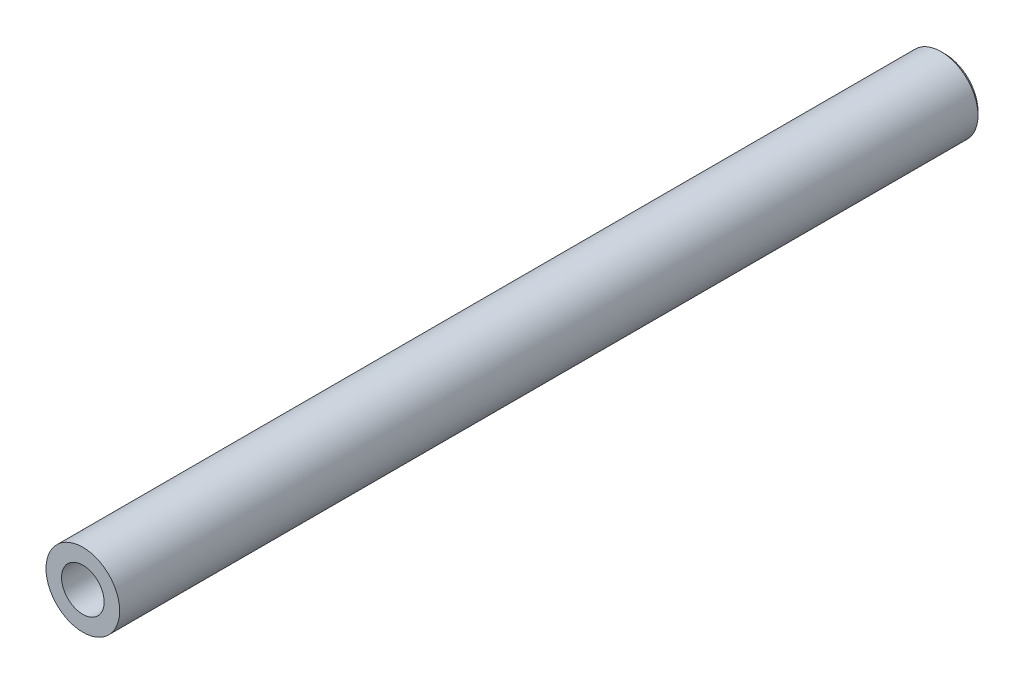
SolidWorks part; units mm, degrees
ref_plane "Front Plane" through (0, 0, 0) normal (0, 0, 1) x (1, 0, 0)
ref_plane "Top Plane" through (0, 0, 0) normal (0, 1, 0) x (1, 0, 0)
ref_plane "Right Plane" through (0, 0, 0) normal (1, 0, 0) x (0, 0, -1)
sketch "Sketch6" plane through (0, 0, 0) normal (0, 0, -1) x (-1, 0, 0)
  circle A0 centre (0, 0) radius 2.9845
  point P3 (0, 0)
extrude "Extrude2" add sketch "Sketch6" along normal blind 69.85 separate body
chamfer "Chamfer1" distance 0.2984 angle 45 1 edges at (-2.9845, 0, -69.85)
hole_wizard "3/16 (0.1875) Diameter Hole1" positions "Sketch12" profile "Sketch11" hole size "3/16" standard "ANSI Inch"
sketch "Sketch12" plane through (0, 0, -69.85) normal (0, 0, -1) x (-1, 0, 0)
  point P0 (0, 0)
sketch "Sketch11" plane through (0, 0, -69.85) normal (1, 0, 0) x (0, 1, 0)
  line L0 (0, 0) -> (0, 7.7808)
  line L1 (0, 7.7808) -> (2.3812, 6.35)
  line L2 (2.3812, 6.35) -> (2.3812, 0)
  line L5 (2.3812, 0) -> (0, 0)
  line L10 (0, 7.7808) -> (-2.3813, 6.35) construction
  line L11 (0, -6.35) -> (0, 107.95) construction
  dimension "Hole Dia." = 4.7625
  dimension "Hole Depth" = 6.35
  dimension "Drill Angle" = 118
hole_wizard "#8-32 Tapped Hole1" positions "Sketch13" profile "Sketch14" tap size "#8-32" standard "ANSI Inch"
sketch "Sketch13" plane through (0, 0, 0) normal (0, 0, 1) x (1, 0, 0)
  point P0 (0, 0)
sketch "Sketch14" plane through (0, 0, 0) normal (1, 0, 0) x (0, -1, 0)
  line L0 (0, 0) -> (0, 17.5478)
  line L1 (0, 17.5478) -> (1.7272, 16.51)
  line L2 (1.7272, 16.51) -> (1.7272, 0)
  line L5 (1.7272, 0) -> (0, 0)
  line L10 (0, 17.5478) -> (-1.7272, 16.51) construction
  line L11 (0, -6.35) -> (0, 107.95) construction
  dimension "Tap Drill Dia." = 3.4544
  dimension "Tap Drill Depth" = 16.51
  dimension "Drill Angle" = 118
equation "\"D3@Helix/Spiral1\" = \"screw length@Extrude1\"+\"pitch@Helix/Spiral1\""
equation "\"D1@Sketch3\" = \"pitch@Helix/Spiral1\"*.125"
equation "\"D2@Sketch3\" = \"pitch@Helix/Spiral1\"*.5"
equation "\"D1@Chamfer1\" = \"head dia@Sketch6\" * .05"
equation "\"D1@Sketch9\" = \"pitch@Helix/Spiral1\"*5.5"
